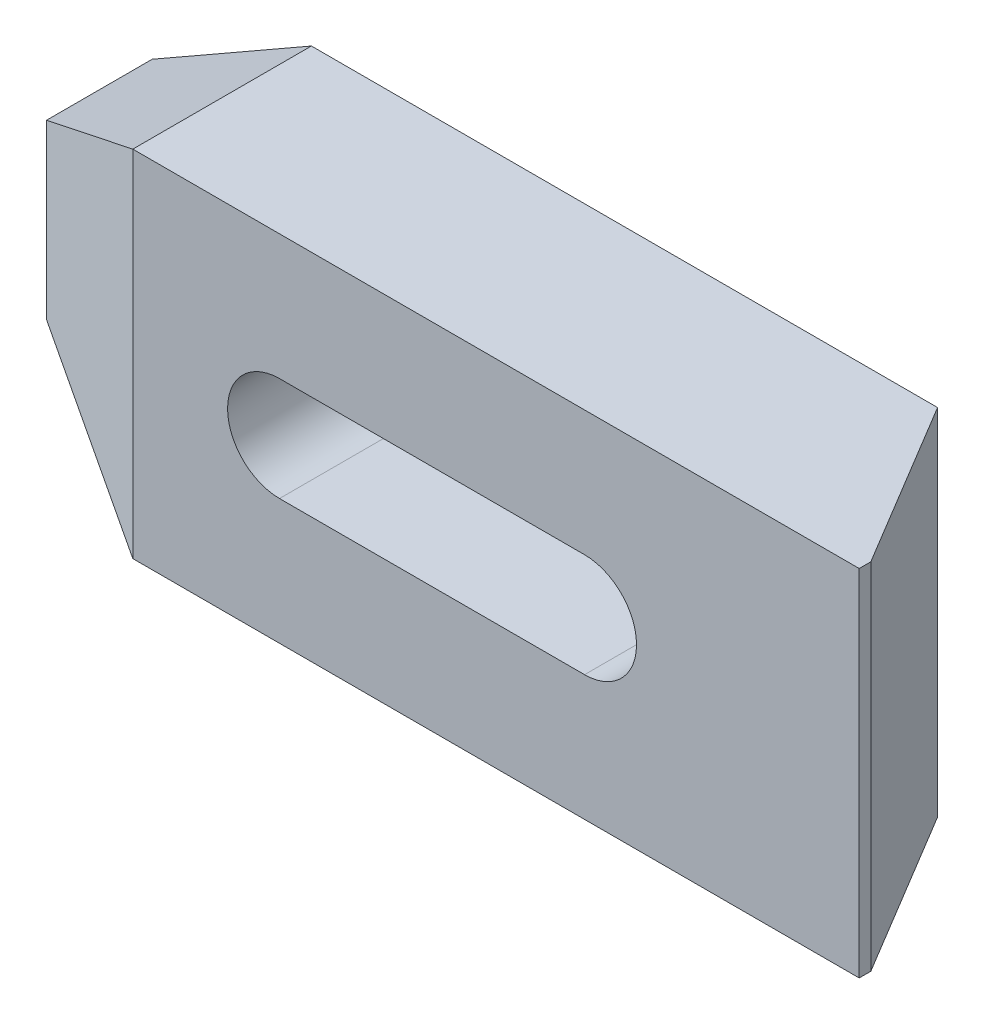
SolidWorks part; units mm, degrees
ref_plane "Front Plane" through (0, 0, 0) normal (0, 0, 1) x (1, 0, 0)
ref_plane "Top Plane" through (0, 0, 0) normal (0, 1, 0) x (1, 0, 0)
ref_plane "Right Plane" through (0, 0, 0) normal (1, 0, 0) x (0, 0, -1)
sketch "Sketch1" plane through (0, 0, 0) normal (0, 0, 1) x (1, 0, 0)
  line L1 (53.7358, 12.3571) -> (104.358, 12.3571)
  line L2 (42.636, 6.0071) -> (42.636, -6.0071)
  line L3 (53.7358, -12.3571) -> (104.358, -12.3571)
  line L4 (104.358, 12.3571) -> (104.358, -12.3571)
  line L5 (88.8386, 0) -> (88.8386, 15.7346) construction
  line L6 (60.3398, 15.7346) -> (88.8386, 15.7346) construction
  line L7 (60.3398, 0) -> (60.3398, 15.7346) construction
  line L8 (63.9593, 3.6195) -> (85.2191, 3.6195)
  line L9 (85.2191, -3.6195) -> (63.9593, -3.6195)
  line L10 (42.636, 6.0071) -> (53.7358, 12.3571)
  line L11 (42.636, -6.0071) -> (53.7358, -12.3571)
  arc A0 (63.9593, 3.6195) -> (63.9593, -3.6195) centre (63.9593, 0) ccw
  arc A1 (85.2191, -3.6195) -> (85.2191, 3.6195) centre (85.2191, 0) ccw
  point P0 (42.636, 12.3571)
  point P2 (42.636, -12.3571)
  point P21 (-6.8017, 21.5351)
  dimension "D4" = 7.239
  dimension "D5" = 28.4988
  dimension "D1" = 61.722
  dimension "D2" = 24.7142
  dimension "D6" = 15.5194
  dimension "D7" = 11.0998
  dimension "D8" = 6.35
  dimension "D9" = 11.0998
  dimension "D10" = 6.35
extrude "Boss-Extrude1" add sketch "Sketch1" along normal blind 12.446
chamfer "Chamfer1" distance 5.08 distance2 11.0998 1 edges at (42.636, 0, 12.446)
sketch "Sketch2" plane through (0, -12.3571, 0) normal (0, -1, 0) x (1, 0, 0)
  line L0 (53.7358, 0) -> (104.358, 0) construction
  line L1 (104.358, 12.446) -> (104.358, 0) construction
  line L2 (97.373, 0) -> (104.358, 0) construction
  line L3 (104.358, 11.6391) -> (104.358, 0) construction
  line L4 (104.358, 11.6391) -> (97.373, 0)
  line L5 (97.373, 0) -> (97.373, -6.4952)
  line L6 (97.373, -6.4952) -> (107.4408, -6.4952)
  line L7 (107.4408, -6.4952) -> (107.4408, 11.6391)
  line L8 (107.4408, 11.6391) -> (104.358, 11.6391)
  dimension "D1" = 6.985
extrude "Cut-Extrude1" cut sketch "Sketch2" against normal through all
